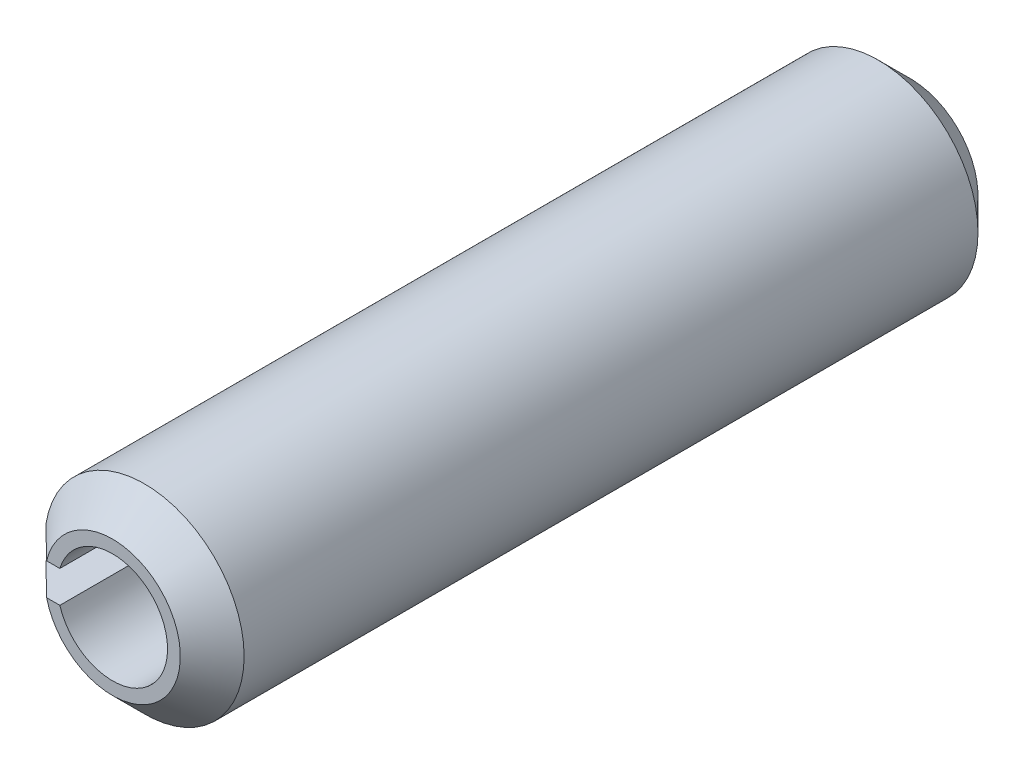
SolidWorks part; units mm, degrees
ref_plane "Front Plane" through (0, 0, 0) normal (0, 0, 1) x (1, 0, 0)
ref_plane "Top Plane" through (0, 0, 0) normal (0, 1, 0) x (1, 0, 0)
ref_plane "Right Plane" through (0, 0, 0) normal (1, 0, 0) x (0, 0, -1)
sketch "Sketch1" plane through (0, 0, 0) normal (0, 0, 1) x (1, 0, 0)
  line L0 (0, 0) -> (-1.5875, 0) construction
  line L1 (-0.8387, 0.254) -> (-1.567, 0.254)
  line L2 (-0.8387, -0.254) -> (-1.567, -0.254)
  line L3 (0, 0.254) -> (-2.2739, 0.254) construction
  line L4 (0, -0.254) -> (-2.2739, -0.254) construction
  line L5 (0, 0) -> (-2.2739, 0) construction
  arc A0 (-1.567, -0.254) -> (-1.567, 0.254) centre (0, 0) ccw
  arc A1 (-0.8387, -0.254) -> (-0.8387, 0.254) centre (0, 0) ccw
  circle A2 centre (0, 0) radius 0.8763 construction
  circle A3 centre (0, 0) radius 1.5875 construction
  dimension "D1" = 3.175
  dimension "D2" = 0.7112
  dimension "D3" = 0.254
  dimension "D4" = 0.254
extrude "Boss-Extrude1" add sketch "Sketch1" along normal mid plane 12.7
chamfer "Chamfer2" distance 0.508 angle 45 2 edges at (1.5875, 0, -6.35) (1.5875, 0, 6.35)
